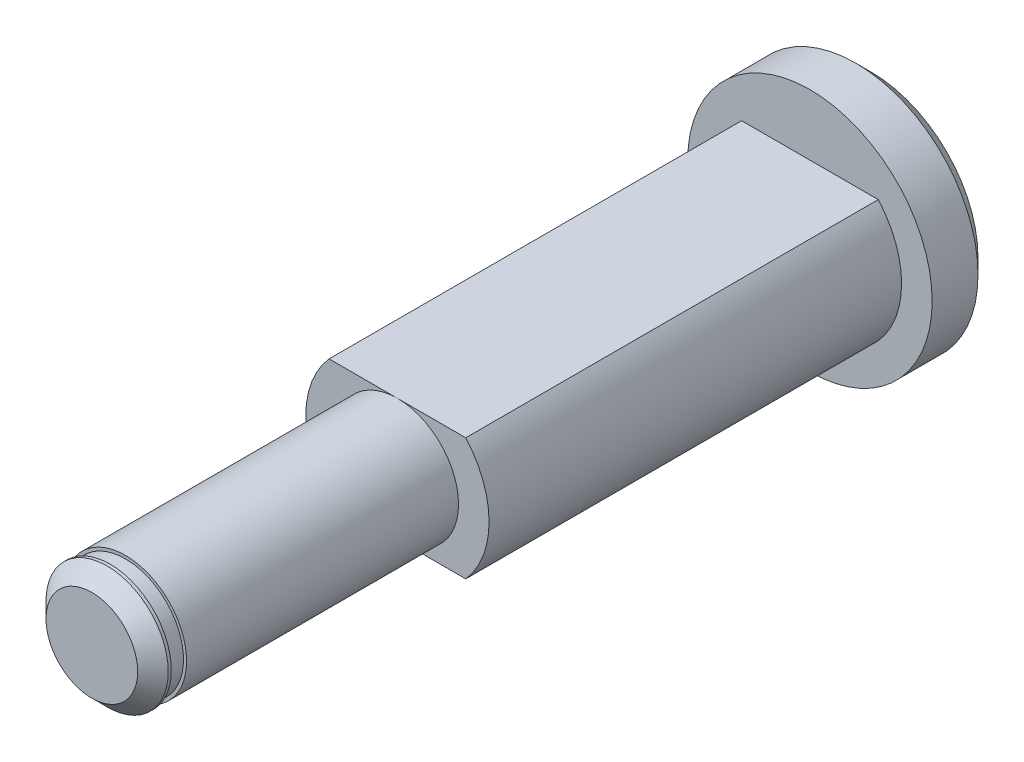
SolidWorks part; units mm, degrees
ref_plane "Plan de face" through (0, 0, 0) normal (0, 0, 1) x (1, 0, 0)
ref_plane "Plan de dessus" through (0, 0, 0) normal (0, 1, 0) x (1, 0, 0)
ref_plane "Plan de droite" through (0, 0, 0) normal (1, 0, 0) x (0, 0, -1)
sketch "Esquisse1" plane through (0, 0, 0) normal (0, 0, 1) x (1, 0, 0)
  circle A0 centre (0, 0) radius 2
  dimension "D1" = 4
extrude "Extrusion1" add sketch "Esquisse1" along normal blind 10
chamfer "Chanfrein1" distance 0.5 angle 45 1 edges at (2, 0, 10)
sketch "Esquisse2" plane through (0, 0, 0) normal (1, 0, 0) x (0, 0, -1)
  line L0 (0, 0) -> (-11.5573, 0) construction
  line L1 (-8.9, 2.3072) -> (-9.4, 2.3072)
  line L2 (-8.9, 2.3072) -> (-8.9, 1.9)
  line L3 (-8.9, 1.9) -> (-9.4, 1.9)
  line L4 (-9.4, 2.3072) -> (-9.4, 1.9)
  dimension "D1" = 9.4
  dimension "D2" = 0.5
  dimension "D3" = 1.9
revolve "Enlèvement de matière-Révolution1" cut sketch "Esquisse2" angle 360 about L0
sketch "Esquisse3" plane through (0, 0, 0) normal (0, 0, 1) x (1, 0, 0)
  circle A0 centre (0, 0) radius 3
  dimension "D1" = 6
extrude "Extrusion2" add sketch "Esquisse3" against normal blind 13.5
sketch "Esquisse4" plane through (0, 0, 0) normal (0, 0, 1) x (1, 0, 0)
  line L1 (-3.7867, 2) -> (4.6734, 2)
  line L2 (-3.7867, 2) -> (-3.7867, -2)
  line L3 (-3.7867, -2) -> (4.6734, -2)
  line L4 (4.6734, 2) -> (4.6734, -2)
  dimension "D1" = 4
  dimension "D2" = 2
extrude "Enlèv. mat.-Extru.2" cut sketch "Esquisse4" against normal through all flip side to cut
sketch "Esquisse5" plane through (0, 0, -13.5) normal (0, 0, -1) x (-1, 0, 0)
  circle A0 centre (0, 0) radius 4
  dimension "D1" = 8
extrude "Extrusion3" add sketch "Esquisse5" along normal blind 2
chamfer "Chanfrein2" distance 0.5 angle 45 1 edges at (-4, 0, -15.5)
